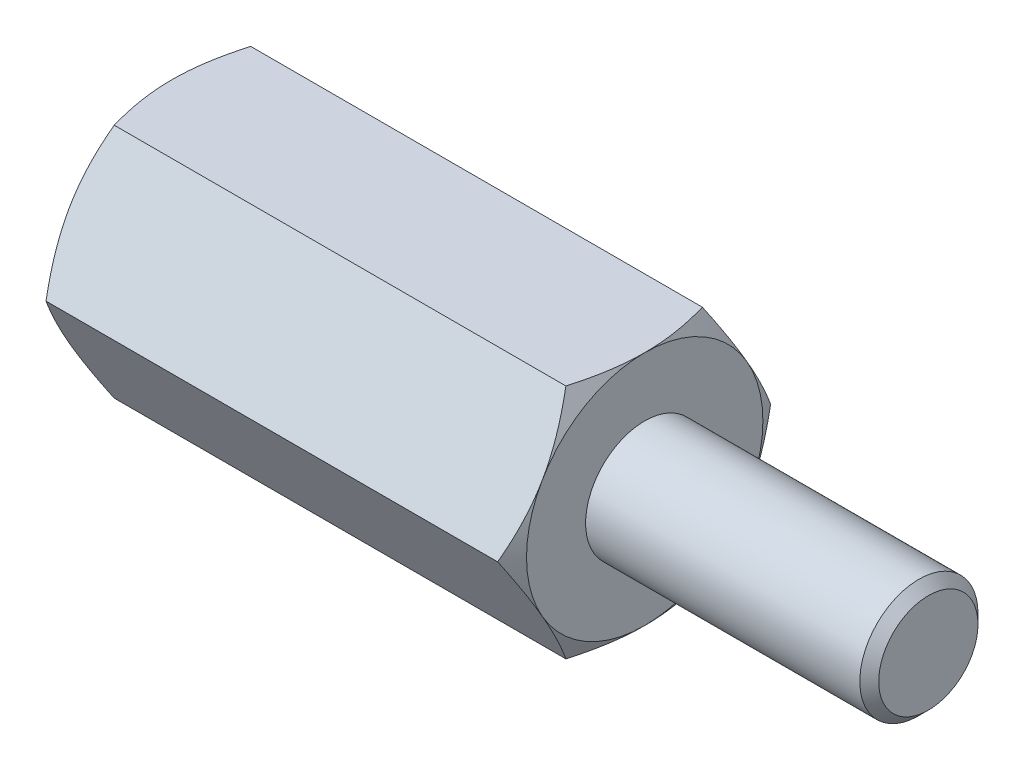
SolidWorks part; units mm, degrees
ref_plane "Front Plane" through (0, 0, 0) normal (0, 0, 1) x (1, 0, 0)
ref_plane "Top Plane" through (0, 0, 0) normal (0, 1, 0) x (1, 0, 0)
ref_plane "Right Plane" through (0, 0, 0) normal (1, 0, 0) x (0, 0, -1)
sketch "Sketch1" plane through (0, 0, 0) normal (1, 0, 0) x (0, 0, -1)
  line L1 (1.4434, 2.5) -> (-1.4434, 2.5)
  line L2 (-1.4434, 2.5) -> (-2.8868, 0)
  line L3 (-2.8868, 0) -> (-1.4434, -2.5)
  line L4 (-1.4434, -2.5) -> (1.4434, -2.5)
  line L5 (1.4434, -2.5) -> (2.8868, 0)
  line L6 (2.8868, 0) -> (1.4434, 2.5)
  circle A0 centre (0, 0) radius 2.5 construction
  dimension "D1" = 5
extrude "Extrude2" add sketch "Sketch1" along normal mid plane 10
sketch "Sketch2" plane through (0, 0, 0) normal (0, 0, 1) x (1, 0, 0)
  line L0 (-5, 2.5) -> (-3.5, 5.0981)
  line L1 (-5, 5.5) -> (-5, 2.5)
  line L3 (0, 0) -> (50000, 0) construction
  arc A0 (-3.5, 5.0981) -> (-5, 5.5) centre (-4.1962, 5.5) ccw
  dimension "D1" = 30
  dimension "D2" = 3
revolve "Cut-Revolve1" cut sketch "Sketch2" angle 360 about L3
mirror "Mirror1" about plane through (0, 0, 0) normal (1, 0, 0) of "Cut-Revolve1"
sketch "Sketch3" plane through (-5, 0, 0) normal (-1, 0, 0) x (0, 0, 1)
  circle A0 centre (0, 0) radius 1.05
  dimension "D1" = 2.1
extrude "Extrude3" cut sketch "Sketch3" against normal blind 5
sketch "Sketch4" plane through (0, 0, 0) normal (0, 0, 1) x (1, 0, 0)
  line L0 (0, 0) -> (0, 1.05)
  line L1 (4.7767, 0) -> (-4.7767, 0) construction
  line L2 (0, 1.05) -> (0.6062, 0)
  line L3 (0.6062, 0) -> (0, 0)
  line L4 (-5, 1.25) -> (-5, -1.25) construction
  point P4 (-5, 0)
  dimension "D1" = 30
  dimension "D2" = 1.05
  dimension "D3" = 5
revolve "Cut-Revolve2" cut sketch "Sketch4" angle 360 about L3
sketch "Sketch5" plane through (5, 0, 0) normal (1, 0, 0) x (0, 0, -1)
  circle A0 centre (0, 0) radius 1.25
  dimension "D1" = 2.5
extrude "Extrude4" add sketch "Sketch5" along normal blind 6
chamfer "Chamfer1" distance 0.2 angle 45 1 edges at (11, 0, -1.25)
equation "\"D2@Sketch4\" = \"D1@Sketch3\"/2"
